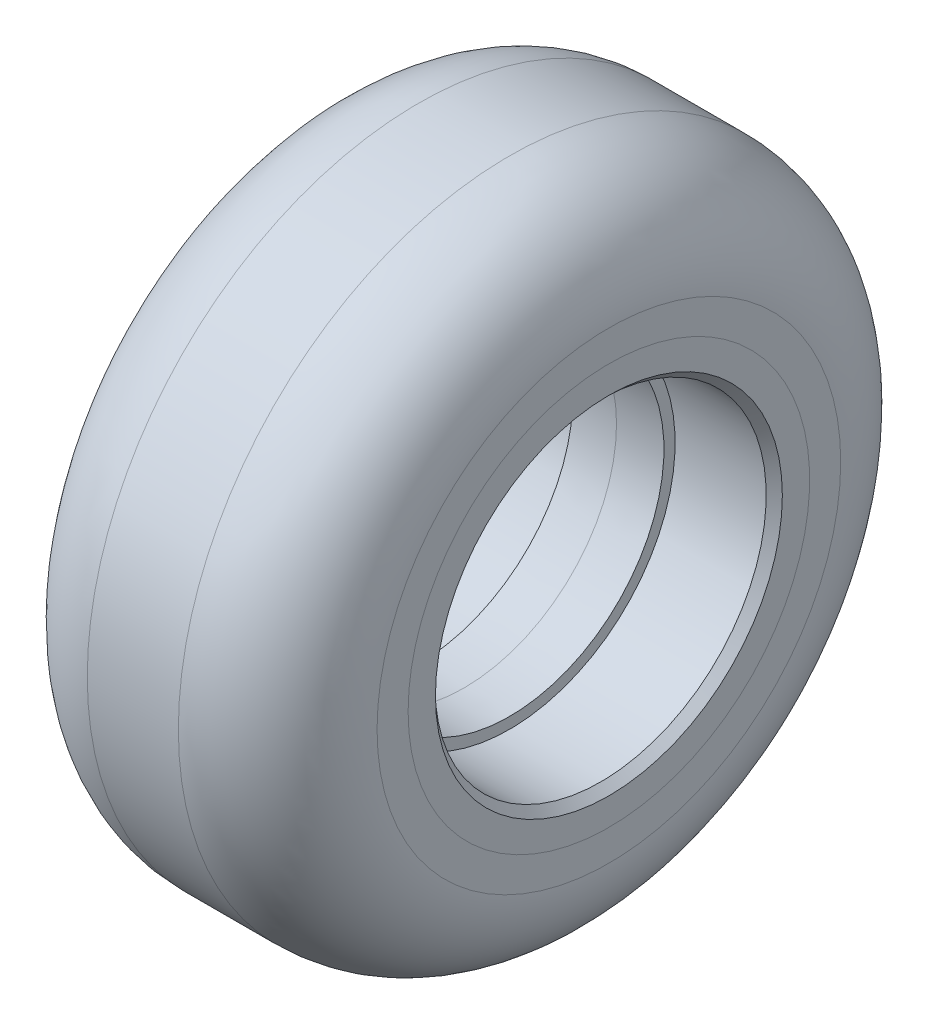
SolidWorks part; units mm, degrees
ref_plane "前视基准面" through (0, 0, 0) normal (0, 0, 1) x (1, 0, 0)
ref_plane "上视基准面" through (0, 0, 0) normal (0, 1, 0) x (1, 0, 0)
ref_plane "右视基准面" through (0, 0, 0) normal (1, 0, 0) x (0, 0, -1)
sketch "草图1" plane through (0, 0, 0) normal (0, 1, 0) x (1, 0, 0)
  line L0 (-22.3159, 0) -> (22.3159, 0) construction
  line L1 (-17.5, 24.25) -> (-17.5, 20.95)
  line L2 (-5.5, 20) -> (-5.5, 18.65)
  line L3 (-16.5, 20) -> (-5.5, 20)
  line L4 (0, 25) -> (-17.5, 24.25)
  line L5 (-16.5, 20) -> (-17.5, 20.95)
  line L6 (17.5, 24.25) -> (17.5, 20.95)
  line L7 (5.5, 20) -> (5.5, 18.65)
  line L8 (16.5, 20) -> (5.5, 20)
  line L9 (0, 25) -> (17.5, 24.25)
  line L10 (16.5, 20) -> (17.5, 20.95)
  line L11 (-5.5, 18.65) -> (0, 18.4208)
  line L12 (5.5, 18.65) -> (0, 18.4208)
revolve "旋转1" add sketch "草图1" angle 360 about L0
sketch "草图2" plane through (0, 0, 0) normal (0, 1, 0) x (1, 0, 0)
  line L0 (-22.3159, 0) -> (22.3159, 0) construction
  line L1 (-5.5, 40) -> (5.5, 40)
  line L2 (0, 25) -> (-17.5, 24.25)
  line L3 (0, 25) -> (17.5, 24.25)
  line L4 (-17.5, 24.25) -> (-17.5, 28)
  line L5 (17.5, 24.25) -> (17.5, 28)
  arc A0 (-5.5, 40) -> (-17.5, 28) centre (-5.5, 28) ccw
  arc A1 (17.5, 28) -> (5.5, 40) centre (5.5, 28) ccw
revolve "旋转2" add sketch "草图2" angle 360 about L0
